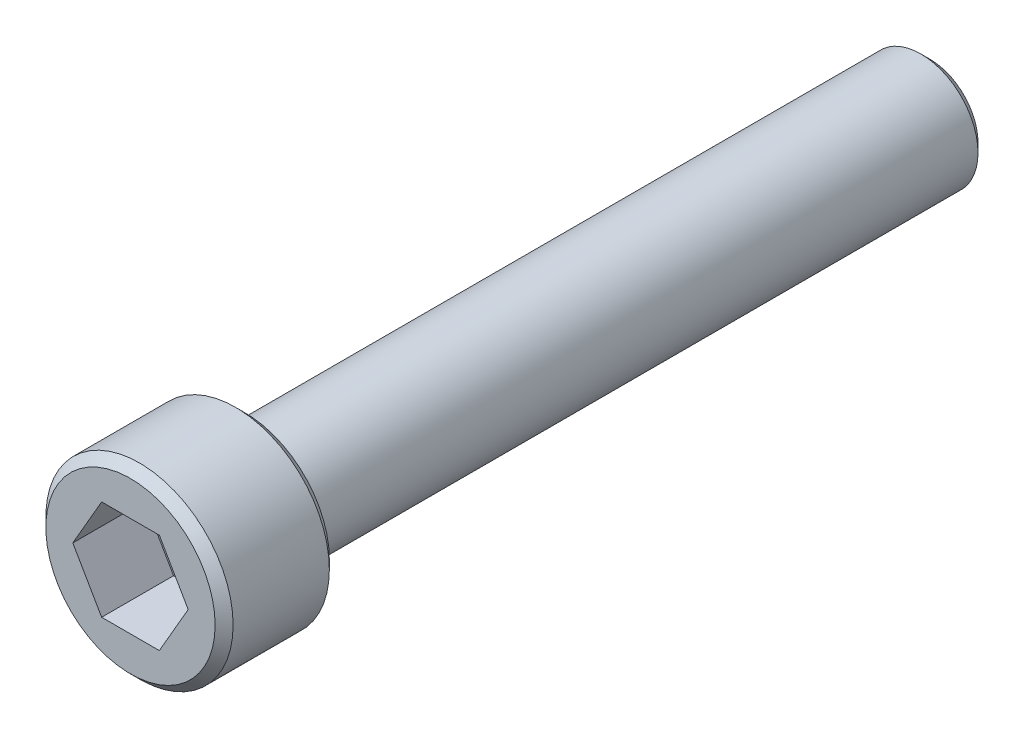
SolidWorks part; units mm, degrees
ref_plane "Front Plane" through (0, 0, 0) normal (1, 0, 0) x (0, 1, 0)
ref_plane "Top Plane" through (0, 0, 0) normal (0, 0, 1) x (0, 1, 0)
ref_plane "Right Plane" through (0, 0, 0) normal (0, 1, 0) x (-1, 0, 0)
sketch "Sketch1" plane through (0, 0, 0) normal (0, 0, 1) x (0, 1, 0)
  circle A0 centre (0, 0) radius 1.5875
  dimension "D1" = 3.175
extrude "Boss-Extrude1" add sketch "Sketch1" along normal blind 19.05
sketch "Sketch2" plane through (0, 0, 19.05) normal (0, 0, 1) x (1, 0, 0)
  circle A0 centre (0, 0) radius 2.6035
  dimension "D1" = 5.207
extrude "Boss-Extrude2" add sketch "Sketch2" along normal blind 3.175
sketch "Sketch3" plane through (0, 0, 22.225) normal (0, 0, 1) x (1, 0, 0)
  line L1 (1.604, 0) -> (0.802, 1.3891)
  line L2 (0.802, 1.3891) -> (-0.802, 1.3891)
  line L3 (-0.802, 1.3891) -> (-1.604, 0)
  line L4 (-1.604, 0) -> (-0.802, -1.3891)
  line L5 (-0.802, -1.3891) -> (0.802, -1.3891)
  line L6 (0.802, -1.3891) -> (1.604, 0)
  circle A0 centre (0, 0) radius 1.3891 construction
  point P1 (0, 0)
  dimension "D1" = 2.7781
extrude "Cut-Extrude1" cut sketch "Sketch3" against normal blind 2
chamfer "Chamfer1" distance 0.25 angle 45 3 edges at (1.5875, 0, 0) (2.6035, 0, 19.05) (2.6035, 0, 22.225)
